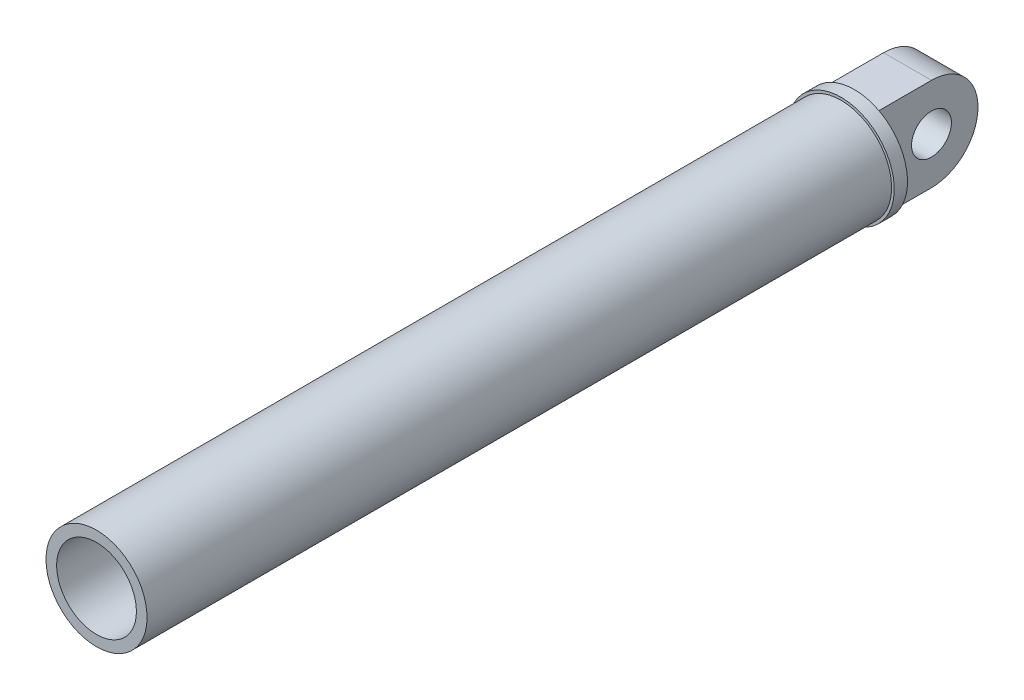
SolidWorks part; units mm, degrees
ref_plane "前视基准面" through (0, 0, 0) normal (0, 0, 1) x (1, 0, 0)
ref_plane "上视基准面" through (0, 0, 0) normal (0, 1, 0) x (1, 0, 0)
ref_plane "右视基准面" through (0, 0, 0) normal (1, 0, 0) x (0, 0, -1)
sketch "草图1" plane through (0, 0, 0) normal (0, 0, 1) x (1, 0, 0)
  circle A0 centre (0, 0) radius 38
  circle A1 centre (0, 0) radius 30
  dimension "D1" = 76
  dimension "D2" = 60
extrude "拉伸1" add sketch "草图1" along normal blind 560
sketch "草图2" plane through (0, 0, 0) normal (0, 0, -1) x (-1, 0, 0)
  circle A0 centre (0, 0) radius 40
  dimension "D1" = 80
extrude "拉伸2" add sketch "草图2" along normal blind 10
sketch "草图3" plane through (0, 0, 0) normal (1, 0, 0) x (0, 0, -1)
  line L0 (118.1868, 0) -> (-65.1423, 0) construction
  line L1 (10, -40) -> (10, 40) construction
  line L2 (50, 35) -> (10, 35)
  line L3 (50, -35) -> (10, -35)
  line L4 (10, -35) -> (10, 35)
  circle A0 centre (50, 0) radius 15
  arc A1 (50, -35) -> (50, 35) centre (50, 0) ccw
  dimension "D1" = 30
  dimension "D2" = 70
  dimension "D3" = 40
extrude "拉伸3" add sketch "草图3" along normal mid plane 36
sketch "草图4" plane through (0, 0, 0) normal (0, 0, 1) x (1, 0, 0)
  circle A1 centre (0, 0) radius 30
  circle A2 centre (0, 0) radius 30
  dimension "D1" = 0
extrude "拉伸4" add sketch "草图4" along normal blind 15
